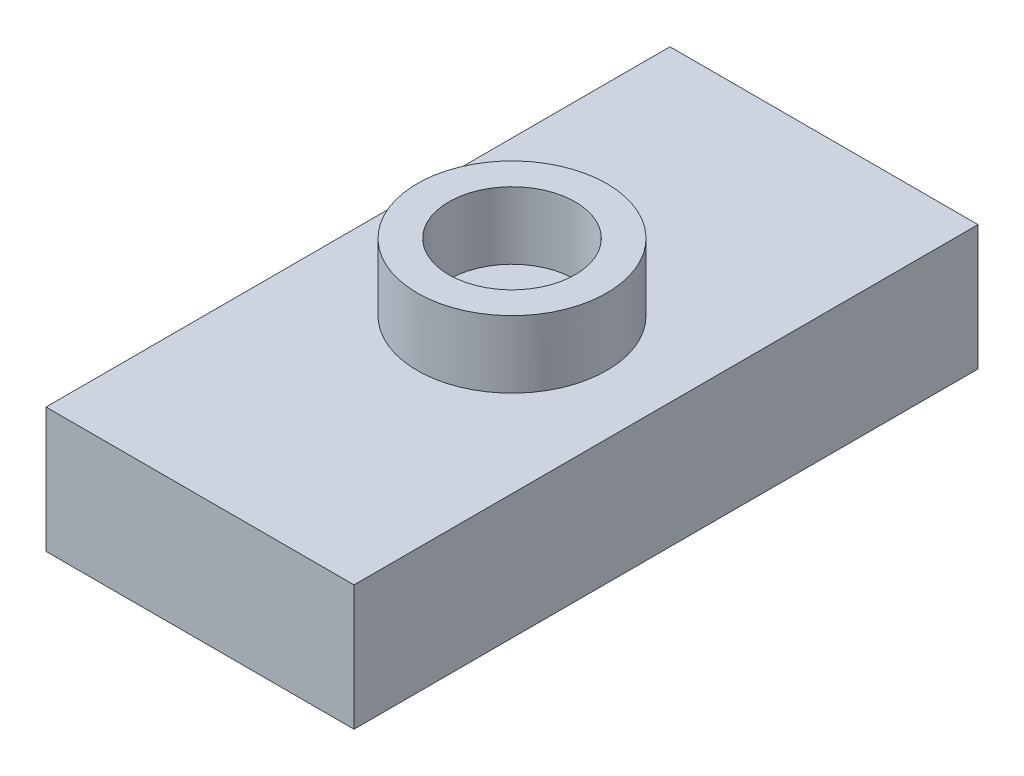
SolidWorks part; units mm, degrees
ref_plane "Front Plane" through (0, 0, 0) normal (0, 0, 1) x (1, 0, 0)
ref_plane "Top Plane" through (0, 0, 0) normal (0, 1, 0) x (1, 0, 0)
ref_plane "Right Plane" through (0, 0, 0) normal (1, 0, 0) x (0, 0, -1)
sketch "Sketch1" plane through (0, 0, 0) normal (0, 1, 0) x (1, 0, 0)
  line L1 (0, 0) -> (7.8, 0)
  line L2 (0, 0) -> (0, 15.8)
  line L3 (0, 15.8) -> (7.8, 15.8)
  line L4 (7.8, 0) -> (7.8, 15.8)
  dimension "D1" = 7.8
  dimension "D2" = 15.8
extrude "Extrude1" add sketch "Sketch1" along normal blind 3.166
sketch "Sketch3" plane through (0, 0, 0) normal (0, -1, 0) x (1, 0, 0)
  line L0 (7.8, 0) -> (7.8, -15.8) construction
  line L1 (1.45, -9.45) -> (6.35, -9.45)
  line L2 (1.45, -9.45) -> (1.45, -14.35)
  line L3 (1.45, -14.35) -> (6.35, -14.35)
  line L4 (6.35, -9.45) -> (6.35, -14.35)
  line L5 (7.8, -15.8) -> (0, -15.8) construction
  dimension "D1" = 4.9
  dimension "D2" = 1.45
  dimension "D3" = 1.45
extrude "Extrude3" cut sketch "Sketch3" against normal blind 2.5
sketch "Sketch4" plane through (0, 3.166, 0) normal (0, 1, 0) x (1, 0, 0)
  line L0 (3.9, 0) -> (3.9, 16.3566) construction
  line L1 (0, 0) -> (7.8, 0) construction
pattern_linear "LPattern2" count 2 spacing 8 along (0, 0, 1) of "Extrude3"
sketch "Sketch5" plane through (0, 3.166, 0) normal (0, 1, 0) x (1, 0, 0)
  line L0 (0, 15.8) -> (7.8, 0) construction
  line L1 (7.8, 15.8) -> (0, 0) construction
  circle A0 centre (3.9, 7.9) radius 2.4
  circle A1 centre (3.9, 7.9) radius 1.6
  dimension "D1" = 4.8
  dimension "D2" = 3.2
extrude "Boss-Extrude1" add sketch "Sketch5" along normal blind 1.7
